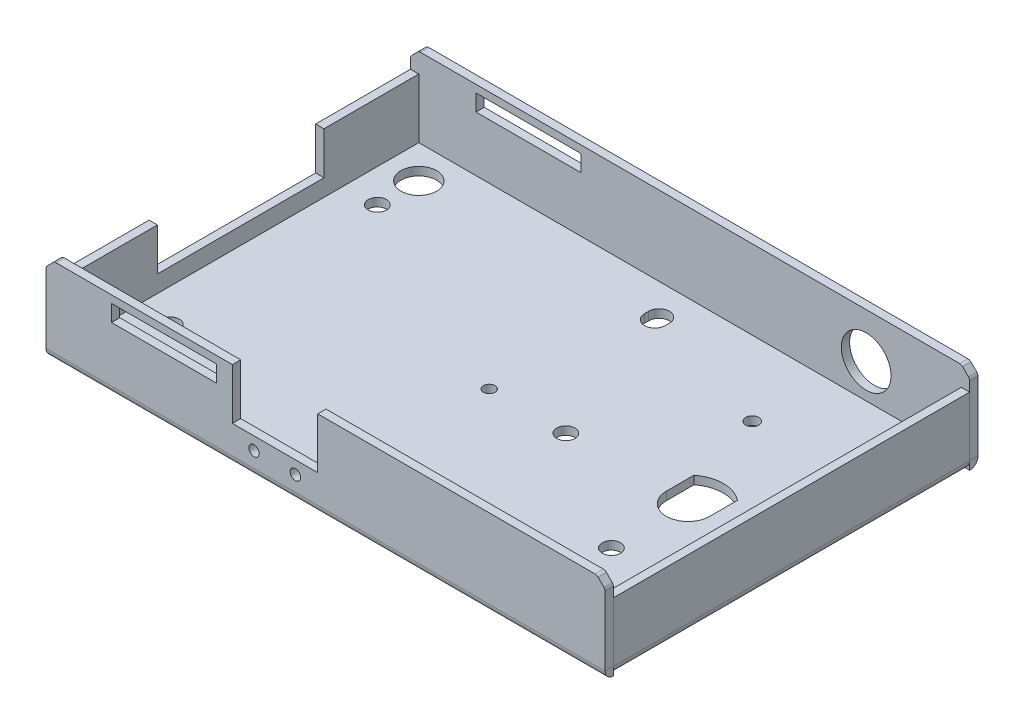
SolidWorks part; units mm, degrees
ref_plane "Vo/Hi" through (0, 0, 0) normal (0, 0, 1) x (1, 0, 0)
ref_plane "Ob/Un" through (0, 0, 0) normal (0, 1, 0) x (1, 0, 0)
ref_plane "Li/Re" through (0, 0, 0) normal (1, 0, 0) x (0, 0, -1)
sketch "Skizze1" plane through (0, 0, 0) normal (0, 1, 0) x (1, 0, 0)
  line L0 (-68.3005, 0) -> (80.6988, 0) construction
  line L1 (-62, 45) -> (73, 45)
  line L2 (-62, 45) -> (-62, -45)
  line L3 (-62, -45) -> (73, -45)
  line L4 (73, 45) -> (73, -45)
  line L5 (-17.1912, 0) -> (17.1912, 0) construction
  line L6 (0, -16.9472) -> (0, 16.9472) construction
  line L7 (3, 35.5) -> (3, 34.5)
  line L8 (8, 35.5) -> (8, 34.5)
  line L9 (-3.2714, 35) -> (14.5376, 35) construction
  line L10 (42.75, 6.6849) -> (42.75, 0)
  line L11 (53.25, 6.6849) -> (53.25, 0)
  line L12 (48, 15.8472) -> (48, -11.1815) construction
  circle A0 centre (18.5, 0) radius 2.2
  circle A1 centre (0, 0) radius 1.4
  circle A2 centre (-52, 35) radius 4.3
  circle A3 centre (63, 35) radius 4.3
  circle A4 centre (-52, -35) radius 4.3
  circle A5 centre (63, -35) radius 4.3
  circle A6 centre (-52, 25) radius 2.2
  circle A7 centre (-52, -25) radius 2.2
  circle A8 centre (48, -18.5) radius 2.2
  circle A9 centre (5.5, -35) radius 2.5
  circle A10 centre (38.5, 25) radius 1.6
  arc A11 (3, 35.5) -> (8, 35.5) centre (5.5, 35.5) cw
  arc A12 (3, 34.5) -> (8, 34.5) centre (5.5, 34.5) ccw
  arc A13 (42.75, 0) -> (53.25, 0) centre (48, 0) ccw
  arc A16 (53.25, 6.6849) -> (42.75, 6.6849) centre (48, 0) ccw
  dimension "D3" = 4.4
  dimension "D4" = 2.8
  dimension "D6" = 18.5
  dimension "D7" = 8.6
  dimension "D8" = 52
  dimension "D9" = 70
  dimension "D10" = 115
  dimension "D11" = 50
  dimension "D12" = 48
  dimension "D14" = 5
  dimension "D15" = 5.5
  dimension "D16" = 9.5
  dimension "D17" = 25
  dimension "D18" = 5.5
  dimension "D19" = 6
  dimension "D21" = 5.25
  dimension "D22" = 8.5
  dimension "D23" = 3.2
  dimension "D1" = 135
  dimension "D2" = 90
  dimension "D5" = 62
  dimension "D13" = 18.5
  dimension "D20" = 5
extrude "Grundkontur_mit_Bohrg." add sketch "Skizze1" along normal blind 21.1
sketch "Skizze3" plane through (0, 21.1, 0) normal (0, 1, 0) x (-1, 0, 0)
  line L0 (62, -45) -> (62, 45) construction
  line L1 (60, -43) -> (-71, -43)
  line L2 (60, -43) -> (60, 43)
  line L3 (60, 43) -> (-71, 43)
  line L4 (-71, -43) -> (-71, 43)
  line L5 (-73, 45) -> (-73, -45) construction
  line L6 (-73, -45) -> (62, -45) construction
  line L7 (62, 45) -> (-73, 45) construction
  dimension "D1" = 2
  dimension "D2" = 2
  dimension "D3" = 2
  dimension "D4" = 2
extrude "Kastenwandung" cut sketch "Skizze3" against normal blind 19.1
sketch "Skizze4" plane through (-62, 0, 0) normal (-1, 0, 0) x (0, 0, 1)
  line L0 (0, 23.7834) -> (0, -5.0006) construction
  line L1 (0, -17.1912) -> (0, 17.1912) construction
  line L2 (-43, 21.1) -> (-43, 16.35)
  line L3 (43, 21.1) -> (43, 16.35)
  line L4 (-45, 21.1) -> (45, 21.1) construction
  line L5 (-43, 21.1) -> (43, 21.1)
  line L6 (-43, 16.35) -> (43, 16.35)
  line L8 (-45, 0) -> (45, 0) construction
  dimension "D1" = 86
  dimension "D2" = 16.35
extrude "Austragung_Stirnfläche" cut sketch "Skizze4" against normal through all
sketch "Skizze5" plane through (-62, 0, 0) normal (-1, 0, 0) x (0, 0, 1)
  line L0 (0, 18.9047) -> (0, -3.537) construction
  line L1 (0, -17.1912) -> (0, 17.1912) construction
  line L2 (-20.1, 16.35) -> (-20.1, 6.1)
  line L3 (-20.1, 6.1) -> (20.1, 6.1)
  line L4 (20.1, 6.1) -> (20.1, 16.35)
  line L5 (-43, 16.35) -> (43, 16.35) construction
  line L6 (-20.1, 16.35) -> (20.1, 16.35)
  dimension "D1" = 40.2
  dimension "D2" = 10.25
extrude "Riegelschart" cut sketch "Skizze5" against normal up to next
sketch "Skizze7" plane through (0, 0, 45) normal (0, 0, 1) x (1, 0, 0)
  line L1 (-46.2, 19.3) -> (-20.8, 19.3)
  line L2 (-46.2, 19.3) -> (-46.2, 15.3)
  line L3 (-46.2, 15.3) -> (-20.8, 15.3)
  line L4 (-20.8, 19.3) -> (-20.8, 15.3)
  line L5 (-33.5, 19.8259) -> (-33.5, 9.9343) construction
  line L7 (-62, 21.1) -> (-62, 0) construction
  line L9 (-62, 0) -> (73, 0) construction
  dimension "D1" = 19.3
  dimension "D2" = 4
  dimension "D3" = 28.5
  dimension "D4" = 25.4
extrude "Basküleschart" cut sketch "Skizze7" against normal through all
sketch "Skizze6" plane through (0, 0, 45) normal (0, 0, 1) x (1, 0, 0)
  line L0 (-62, 21.1) -> (73, 21.1) construction
  line L1 (-17, 21.1) -> (3.6, 21.1)
  line L2 (-17, 21.1) -> (-17, 8.8)
  line L3 (-17, 8.8) -> (3.6, 8.8)
  line L4 (3.6, 8.8) -> (3.6, 21.1)
  line L5 (-62, 21.1) -> (-62, 0) construction
  dimension "D1" = 45
  dimension "D2" = 20.6
  dimension "D3" = 12.3
extrude "Ausnehmung_Seitenwand" cut sketch "Skizze6" against normal up to next
hole_wizard "M3x0.5 Gewindekernloch1" positions "Skizze9" profile "Skizze8" tap size "M3x0.5" standard "DIN"
sketch "Skizze9" plane through (0, 0, 45) normal (0, 0, 1) x (1, 0, 0)
  line L0 (-17, 21.1) -> (-17, 8.8) construction
  line L3 (73, 21.1) -> (-62, 21.1) construction
  point P0 (-11.8, 5.7)
  point P1 (-1.8, 5.7)
  dimension "D1" = 15.4
  dimension "D2" = 10
  dimension "D3" = 5.2
sketch "Skizze8" plane through (-11.8, 5.7, 45) normal (1, 0, 0) x (0, -1, 0)
  line L0 (0, 0) -> (0, 2)
  line L1 (0, 2) -> (1.25, 2)
  line L2 (1.25, 2) -> (1.25, 0)
  line L5 (1.25, 0) -> (0, 0)
  line L11 (0, -6.35) -> (0, 107.95) construction
  dimension "Bohrerdurchmesser" = 2.5
  dimension "Bohrungstiefe" = 2
chamfer "Fase_2x45°_Seitenwand" distance 2 angle 45 4 edges at (73, 21.1, 44) (73, 21.1, -44) (-62, 21.1, 44) (-62, 21.1, -44)
fillet "Verrdg_Fase_Seitenwand" radius 1 8 edges at (-60, 21.1, 44) (-62, 19.1, -44) (-62, 19.1, 44) (71, 21.1, -44) (-60, 21.1, -44) (71, 21.1, 44) (73, 19.1, -44) (73, 19.1, 44)
rip "Schlitz3"
sketch "Skizze11" plane through (0, 0, 0) normal (0, 0, 1) x (1, 0, 0)
  line L1 (3.6, 21.1) -> (70.5858, 21.1) construction
  line L2 (0, -16.9472) -> (0, 16.9472) construction
  circle A0 centre (48, 10.25) radius 6
  dimension "D1" = 12
  dimension "D2" = 10.85
  dimension "D3" = 48
extrude "MagnetBohrung" cut sketch "Skizze11" against normal through all
sheet metal parameters "Blech1" parameters "D1"=0, "Dicke"=2
bend "Biegung-Winkel4" bend angle 90 parameters "D1"=0, "D5"=1
flatten bends "Abwickeln1" parameters "D1"=0
sketch "Skizze-Winkel1" plane through (0, 2, 0) normal (0, 1, 0) x (-1, 0, 0)
  line L0 (-73, -43.575) -> (62, -43.575) construction
  line L1 (-71.575, 42.99) -> (-71.575, -42.99) construction
  line L2 (62, 43.575) -> (-73, 43.575) construction
  line L3 (60.575, -42.99) -> (60.575, 42.99) construction
bend "Biegung-Winkel1" bend angle 90 parameters "D1"=0, "D5"=4
bend "Biegung-Winkel2" bend angle 90 parameters "D1"=0, "D5"=3
bend "Biegung-Winkel3" bend angle 90 parameters "D1"=0, "D5"=2
process bends "Abbiegen1" parameters "D1"=0
sketch "Abwicklung-Skizze1" plane through (0, 2, 0) normal (0, 1, 0) x (-1, 0, 0)
